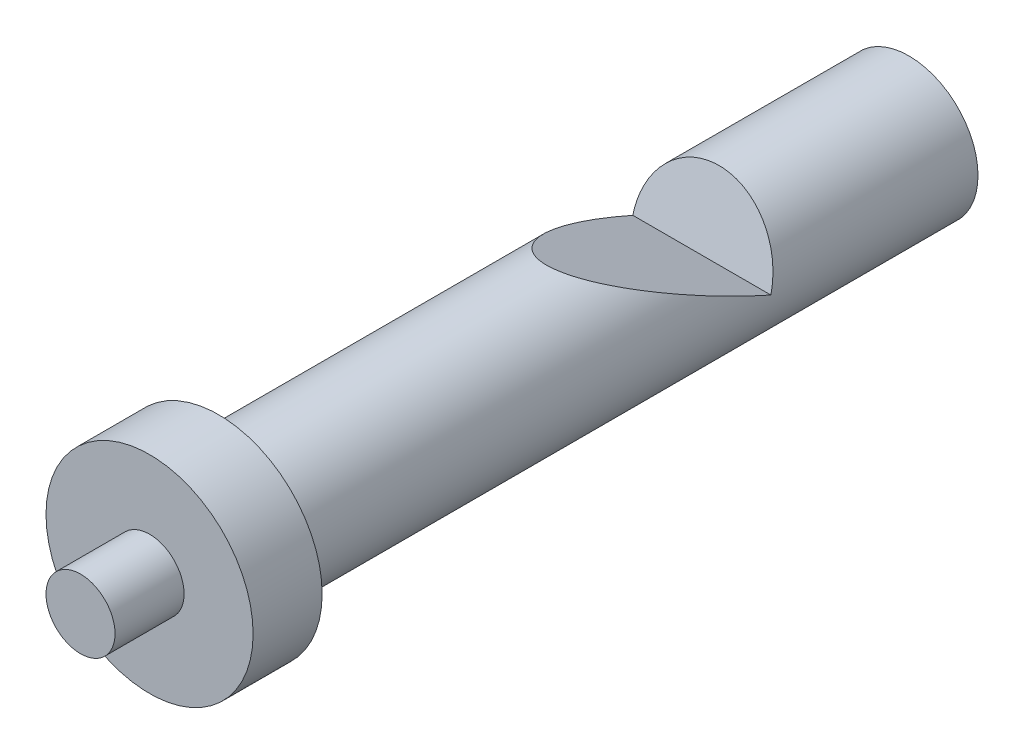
SolidWorks part; units mm, degrees
ref_plane "前视基准面" through (0, 0, 0) normal (0, 0, 1) x (1, 0, 0)
ref_plane "上视基准面" through (0, 0, 0) normal (0, 1, 0) x (1, 0, 0)
ref_plane "右视基准面" through (0, 0, 0) normal (1, 0, 0) x (0, 0, -1)
sketch "草图1" plane through (0, 0, 0) normal (0, 0, 1) x (1, 0, 0)
  circle A0 centre (-7, 33) radius 3
  circle A1 centre (-7, 33) radius 3 construction
extrude "拉伸1" add sketch "草图1" against normal blind 2
sketch "草图2" plane through (0, 0, -2) normal (0, 0, -1) x (-1, 0, 0)
  circle A0 centre (7, 33) radius 2
  dimension "D1" = 4
extrude "拉伸2" add sketch "草图2" along normal blind 20
sketch "草图3" plane through (-7, 0, 0) normal (1, 0, 0) x (0, 0, -1)
  line L0 (-6.4706, 33) -> (22, 33) construction
  line L1 (22, 31) -> (22, 35) construction
  line L2 (18.5, 43) -> (16, 33) construction
  line L3 (16, 33) -> (11.5, 35) construction
  line L4 (11.5, 33) -> (11.5, 35) construction
  line L5 (0, 36) -> (0, 30) construction
  line L6 (16.5, 35) -> (16, 33)
  line L7 (16, 33) -> (11.5, 35)
  line L8 (11.5, 35) -> (16.5, 35)
  dimension "D1" = 16
  dimension "D2" = 2
extrude "切除-拉伸1" cut sketch "草图3" against normal up to next and the other way up to next
sketch "草图4" plane through (0, 0, 0) normal (0, 0, 1) x (1, 0, 0)
  circle A0 centre (-7, 33) radius 1
  dimension "D1" = 2
extrude "拉伸3" add sketch "草图4" along normal blind 2
